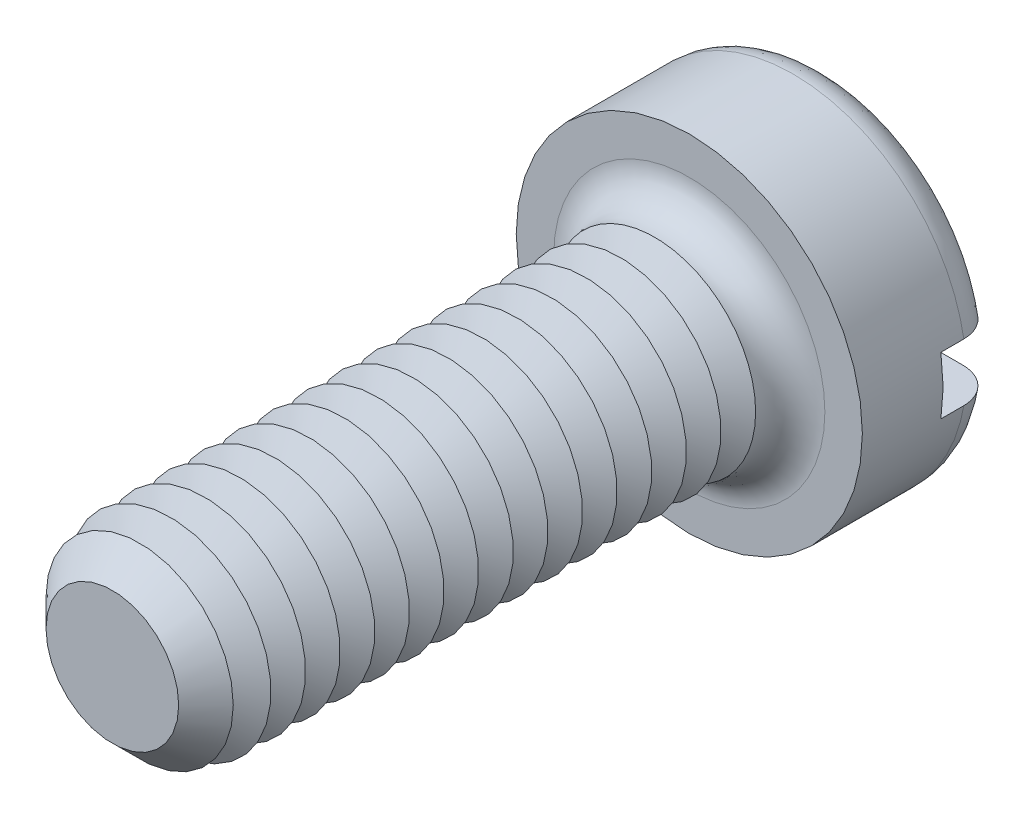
SolidWorks part; units mm, degrees
ref_plane "Front Plane" through (0, 0, 0) normal (0, 0, 1) x (1, 0, 0)
ref_plane "Top Plane" through (0, 0, 0) normal (0, 1, 0) x (1, 0, 0)
ref_plane "Right Plane" through (0, 0, 0) normal (1, 0, 0) x (0, 0, -1)
sketch "Sketch3" plane through (0, 0, 0) normal (0, 0, 1) x (1, 0, 0)
  circle A0 centre (0, 0) radius 3
  dimension "D1" = 6
extrude "Boss-Extrude2" add sketch "Sketch3" against normal blind 2.4
sketch "Sketch4" plane through (0, 0, 0) normal (0, 0, 1) x (1, 0, 0)
  circle A0 centre (0, 0) radius 1.75
  dimension "D1" = 3.5
extrude "Boss-Extrude3" add sketch "Sketch4" along normal blind 10
fillet "Fillet1" radius 0.6 2 edges at (3, 0, -2.4) (1.75, 0, 0)
chamfer "Chamfer1" distance 0.6 angle 45 1 edges at (1.75, 0, 10)
sketch "Sketch5" plane through (0, 0, 0) normal (1, 0, 0) x (0, 0, -1)
  line L0 (1.6944, 0) -> (-7.6738, 0) construction
sketch "Sketch6" plane through (0, 0, 0) normal (1, 0, 0) x (0, 0, -1)
  line L0 (-0.6, 1.75) -> (-0.9, 1.2304)
  line L1 (-0.9, 1.2304) -> (-1.2, 1.75)
  line L2 (-0.6, 1.75) -> (-9.4, 1.75) construction
  line L3 (-1.2, 1.75) -> (-0.6, 1.75)
  dimension "D1" = 0.6
revolve "Cut-Revolve1" cut sketch "Sketch6" angle 360 about L0
pattern_linear "LPattern1" count 15 spacing 0.6 along (0, 0, 1) of "Cut-Revolve1"
sketch "Sketch8" plane through (0, 0, -2.4) normal (0, 0, -1) x (-1, 0, 0)
  line L1 (3, -0.5) -> (-3, -0.5)
  line L2 (3, -0.5) -> (3, 0.5)
  line L3 (3, 0.5) -> (-3, 0.5)
  line L4 (-3, -0.5) -> (-3, 0.5)
  line L5 (3, -0.5) -> (-3, 0.5) construction
  line L6 (3, 0.5) -> (-3, -0.5) construction
  point P0 (0, 0)
  dimension "D1" = 6
  dimension "D2" = 1
extrude "Cut-Extrude1" cut sketch "Sketch8" against normal blind 1
